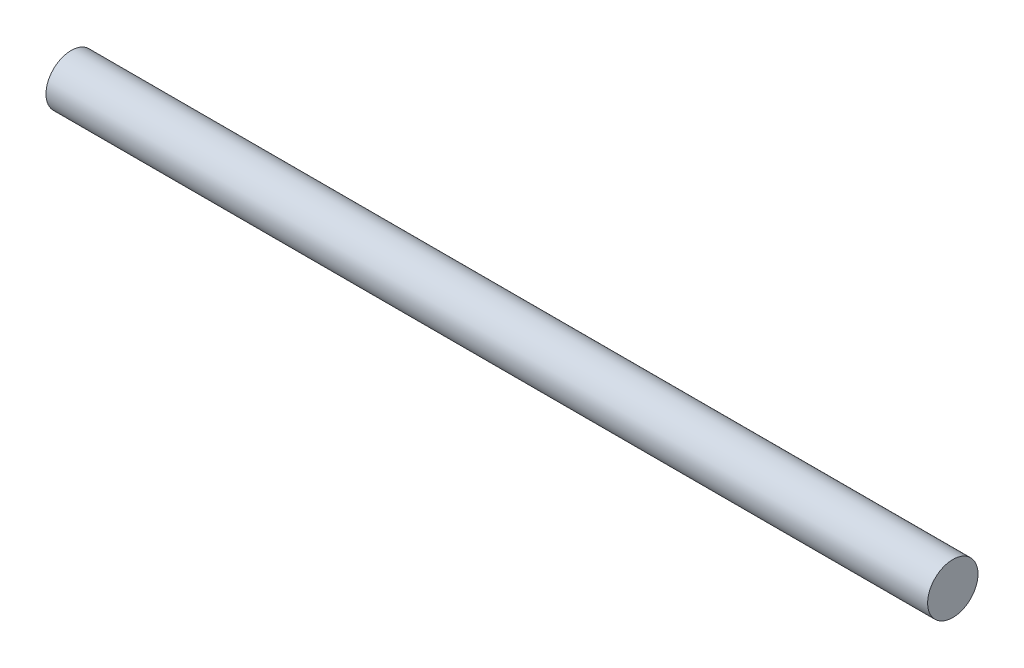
SolidWorks part; units mm, degrees
ref_plane "Plan de face" through (0, 0, 0) normal (0, 0, 1) x (1, 0, 0)
ref_plane "Plan de dessus" through (0, 0, 0) normal (0, 1, 0) x (1, 0, 0)
ref_plane "Plan de droite" through (0, 0, 0) normal (1, 0, 0) x (0, 0, -1)
sketch "Esquisse1" plane through (0, 0, 0) normal (1, 0, 0) x (0, 0, -1)
  circle A0 centre (0, 0) radius 4
  dimension "D1" = 8
extrude "Boss.-Extru.1" add sketch "Esquisse1" along normal mid plane 140
